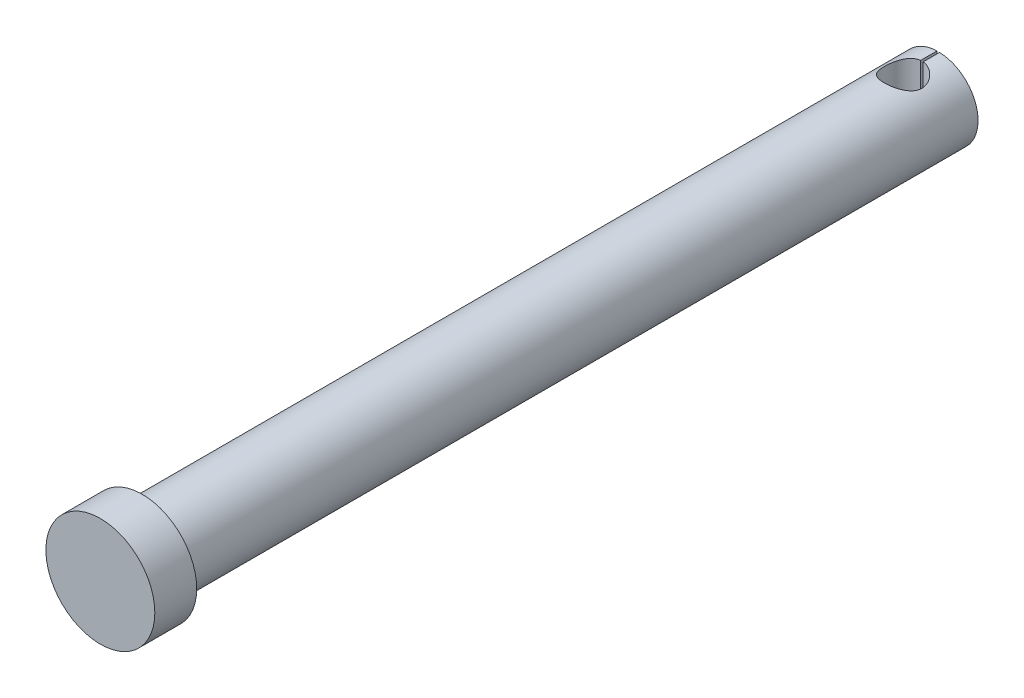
SolidWorks part; units mm, degrees
ref_plane "Plan de face" through (0, 0, 0) normal (0, 0, 1) x (1, 0, 0)
ref_plane "Plan de dessus" through (0, 0, 0) normal (0, 1, 0) x (1, 0, 0)
ref_plane "Plan de droite" through (0, 0, 0) normal (1, 0, 0) x (0, 0, -1)
sketch "Esquisse1" plane through (0, 0, 0) normal (0, 0, 1) x (1, 0, 0)
  circle A0 centre (0, 0) radius 4.75
  dimension "D1" = 9.5
extrude "Boss.-Extru.1" add sketch "Esquisse1" along normal blind 100
sketch "Esquisse3" plane through (0, 0, 100) normal (0, 0, 1) x (1, 0, 0)
  circle A0 centre (0, 0) radius 6.5
  dimension "D1" = 13
extrude "Boss.-Extru.2" add sketch "Esquisse3" against normal blind 5
fillet "Congé1" radius 0.5 1 edges at (4.75, 0, 95)
sketch "Esquisse2" plane through (0, 0, 0) normal (0, 1, 0) x (1, 0, 0)
  line L2 (6.5, -95) -> (-6.5, -95) construction
  circle A0 centre (0, -4.2) radius 2.25
  dimension "D1" = 4.5
  dimension "D2" = 90.8
extrude "Enlèv. mat.-Extru.1" cut sketch "Esquisse2" against normal mid plane 100
sketch "Esquisse4" plane through (0, 0, 0) normal (0, 1, 0) x (1, 0, 0)
  line L0 (0, 0) -> (0, -20.7371) construction
  line L1 (-0.15, 1) -> (0.15, 1)
  line L2 (-0.15, 1) -> (-0.15, -4)
  line L3 (-0.15, -4) -> (0.15, -4)
  line L4 (0.15, 1) -> (0.15, -4)
  dimension "D1" = 0.3
  dimension "D2" = 4
  dimension "D3" = 1
extrude "Enlèv. mat.-Extru.2" cut sketch "Esquisse4" against normal mid plane 15
